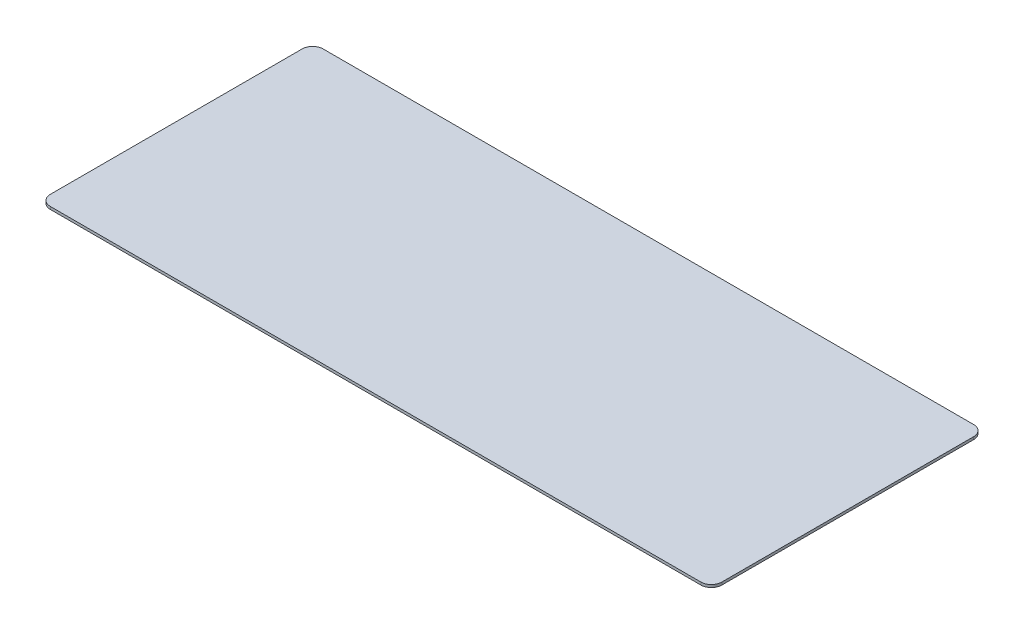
SolidWorks part; units mm, degrees
ref_plane "Front Plane" through (0, 0, 0) normal (0, 0, 1) x (1, 0, 0)
ref_plane "Top Plane" through (0, 0, 0) normal (0, 1, 0) x (1, 0, 0)
ref_plane "Right Plane" through (0, 0, 0) normal (1, 0, 0) x (0, 0, -1)
sketch "Sketch1" plane through (0, 0, 0) normal (0, 1, 0) x (1, 0, 0)
  line L1 (812.8, -330.2) -> (-812.8, -330.2)
  line L2 (812.8, -330.2) -> (812.8, 330.2)
  line L3 (812.8, 330.2) -> (-812.8, 330.2)
  line L4 (-812.8, -330.2) -> (-812.8, 330.2)
  line L5 (812.8, -330.2) -> (-812.8, 330.2) construction
  line L6 (812.8, 330.2) -> (-812.8, -330.2) construction
  point P0 (0, 0)
  dimension "D1" = 660.4
  dimension "D2" = 1625.6
extrude "Boss-Extrude1" add sketch "Sketch1" along normal blind 6.35
fillet "Fillet1" radius 25.4 4 edges at (812.8, 3.175, 330.2) (812.8, 3.175, -330.2) (-812.8, 3.175, 330.2) (-812.8, 3.175, -330.2)
equation "\"D2@Sketch1\" = \"D2@Desk Control Sketch@CF Desk Tube Frame-1.Part\"+4"
equation "\"D1@Sketch1\" = \"D3@Desk Control Sketch@CF Desk Tube Frame-1.Part\"+2"
